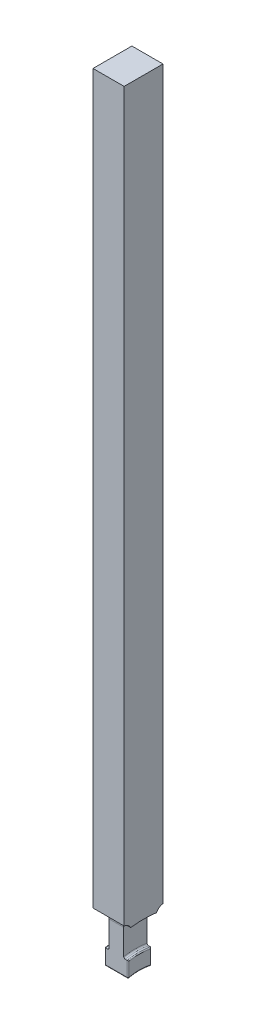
SolidWorks part; units mm, degrees
ref_plane "Front Plane" through (0, 0, 0) normal (0, 0, 1) x (1, 0, 0)
ref_plane "Top Plane" through (0, 0, 0) normal (0, 1, 0) x (1, 0, 0)
ref_plane "Right Plane" through (0, 0, 0) normal (1, 0, 0) x (0, 0, -1)
sketch "Sketch1" plane through (0, 0, 0) normal (1, 0, 0) x (0, 0, -1)
  line L0 (-5, 212) -> (-5, 0)
  line L1 (0, 249.2329) -> (0, 0) construction
  line L2 (5, 212) -> (5, 0)
  line L3 (-5, 212) -> (5, 212)
  line L6 (-5, 0) -> (5, 0)
  arc A0 (-12, 0) -> (12, 0) centre (0, 0) cw construction
  dimension "R" = 12
  dimension "L" = 200
  dimension "T" = 10
extrude "Boss-Extrude1" add sketch "Sketch1" along normal mid plane 8
sketch "Sketch8" plane through (0, 0, 0) normal (1, 0, 0) x (0, 0, -1)
  circle A0 centre (0, 0) radius 12
  arc A1 (12, 0) -> (-12, 0) centre (0, 0) ccw construction
extrude "Cut-Extrude4" cut sketch "Sketch8" against normal through all both and the other way through all
sketch "Sketch2" plane through (0, 0, 0) normal (0, 0, 1) x (1, 0, 0)
  line L0 (4, 16) -> (1.905, 16)
  line L1 (4, 212) -> (4, 10.9087) construction
  line L2 (1.905, 16) -> (1.905, 24)
  line L3 (1.905, 24) -> (4, 24)
  line L4 (4, 24) -> (4, 16)
  line L5 (0, 29.9173) -> (0, 0) construction
  line L6 (-4, 24) -> (-4, 16)
  line L7 (-1.905, 24) -> (-4, 24)
  line L8 (-1.905, 16) -> (-1.905, 24)
  line L9 (-4, 16) -> (-1.905, 16)
  line L10 (-8.8482, 0) -> (24.5305, 0) construction
  dimension "D1" = 3.81
  dimension "D2" = 24
  dimension "D3" = 16
revolve "Cut-Revolve1" cut sketch "Sketch2" angle 360 about L10
sketch "Sketch6" plane through (0, 0, 0) normal (1, 0, 0) x (0, 0, -1)
  line L0 (0, 19.903) -> (0, 0) construction
  line L1 (3, 0) -> (22.05, 0)
  line L2 (3, 0) -> (3, 22.6124)
  line L3 (5.3876, 25) -> (22.05, 25)
  line L4 (22.05, 0) -> (22.05, 25)
  line L9 (-3, 0) -> (-22.05, 0)
  line L10 (-22.05, 0) -> (-22.05, 25)
  line L11 (-5.3876, 25) -> (-22.05, 25)
  line L12 (-3, 0) -> (-3, 22.6124)
  arc A0 (3, 22.6124) -> (5.3876, 25) centre (5.3876, 22.6124) cw
  arc A1 (-3, 22.6124) -> (-5.3876, 25) centre (-5.3876, 22.6124) ccw
  dimension "D3" = 2.3876
  dimension "D1" = 25
  dimension "MT" = 6
  dimension "D2" = 19.05
extrude "Cut-Extrude2" cut sketch "Sketch6" against normal through all both and the other way through all
sketch "Sketch7" plane through (0, 0, 0) normal (0, 0, 1) x (1, 0, 0)
  line L6 (-4, 16) -> (-3, 16)
  line L8 (-4, 16) -> (-4, 0)
  line L9 (-4, 0) -> (-3, 0)
  line L10 (-3, 16) -> (-3, 0)
  line L11 (0, 16.5651) -> (0, 5.9342) construction
  line L12 (3, 16) -> (3, 0)
  line L13 (4, 0) -> (3, 0)
  line L14 (4, 16) -> (4, 0)
  line L15 (4, 16) -> (3, 16)
  dimension "MW" = 6
extrude "Cut-Extrude3" cut sketch "Sketch7" against normal through all both and the other way through all
fillet "Fillet1" radius 0.762 2 edges at (-1.905, 24, 0) (1.905, 24, 0)
fillet "Fillet2" radius 0.381 2 edges at (-1.905, 16, 0) (1.905, 16, 0)
fillet "Fillet3" radius 0.254 10 edges at (3, 13.6676, -3) (3, 13.6676, 3) (3, 16, 0) (-3, 13.6676, 3) (-3, 13.6676, -3) (-3, 16, 0) (3, 12, 0) (-3, 12, 0) (0, 11.619, -3) (0, 11.619, 3)
